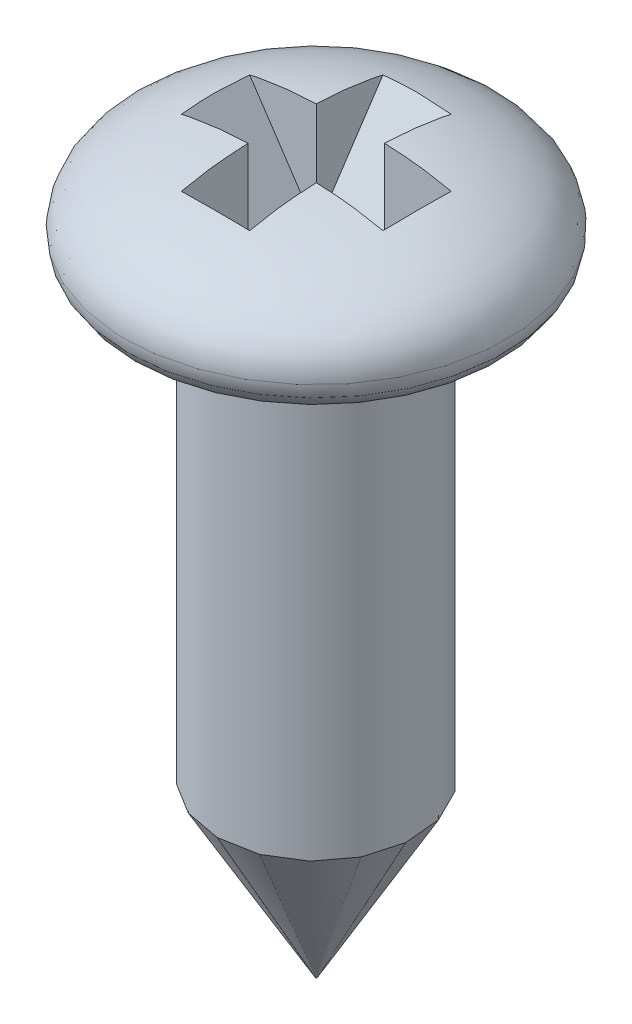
SolidWorks part; units mm, degrees
ref_plane "Plan de face" through (0, 0, 0) normal (0, 0, 1) x (1, 0, 0)
ref_plane "Plan de dessus" through (0, 0, 0) normal (0, 1, 0) x (1, 0, 0)
ref_plane "Plan de droite" through (0, 0, 0) normal (1, 0, 0) x (0, 0, -1)
ref_plane "Plan3" through (0, 6.4, 0) normal (0, 1, 0) x (-1, 0, 0)
sketch "Esquisse1" plane through (0, 6.4, 0) normal (0, 1, 0) x (-1, 0, 0)
  circle A0 centre (0, 0) radius 1.45
extrude "Extrusion1" add sketch "Esquisse1" against normal blind 9
sketch "Esquisse2" plane through (0, 0, 0) normal (0, 0, 1) x (1, 0, 0)
  line L0 (-3.5764, 6.4) -> (3.9855, 6.4) construction
  line L1 (0, 8.9067) -> (0, 4.7448) construction
  line L2 (-2.6992, 8) -> (4.0303, 8) construction
  line L3 (-2.8, 8.6386) -> (-2.8, 5.3938) construction
  line L4 (0, 6.4) -> (-2.3, 6.4)
  line L5 (0, 8) -> (0, 6.4)
  arc A0 (-2.3, 6.4) -> (-2.8, 6.9001) centre (-2.3, 6.9) cw
  spline S0 degree 3 poles (-2.8, 6.9001) (-2.802, 7.3106) (-1.7042, 7.9956) (-0.6729, 7.9983) (0, 8) knots 0 0 0 0 0.347597 1 1 1 1
  point P15 (-2.8, 6.4)
  point P18 (-2.8, 8)
  point P21 (0, 6.4)
  dimension "D1" = 0.5
revolve "Révolution1" add sketch "Esquisse2" angle 360 about L1
sketch "Esquisse3" plane through (0, 0, 0) normal (0, 0, 1) x (1, 0, 0)
  line L0 (0, 9.9885) -> (0, 5.1977) construction
  line L1 (-3.3122, 6.4) -> (4.0377, 6.4) construction
  line L2 (-3.6691, 0) -> (6.2564, 0) construction
  line L3 (-1.5, 8.9361) -> (-1.5, 5.7428) construction
  line L4 (-0.5, 7.218) -> (-0.5, 5.7428) construction
  line L5 (0, 8.589) -> (-1.5, 8.3981)
  line L6 (-2.5295, 7.9) -> (1.4809, 7.9) construction
  line L7 (-1.5, 8.3981) -> (-1.5, 7.9)
  line L8 (-1.5, 7.9) -> (-0.5, 6.4)
  line L9 (-0.5, 6.4) -> (0.5, 6.4)
  line L10 (1.5, 7.9) -> (0.5, 6.4)
  line L11 (1.5, 8.3981) -> (1.5, 7.9)
  line L12 (0, 8.589) -> (1.5, 8.3981)
  point P19 (0, 6.4)
extrude "Enlèv. mat.-Extru.1" cut sketch "Esquisse3" against normal mid plane 1
pattern_circular "Répétition circulaire1" count 2 every 90 about axis through (0, 0, 0) along (0, 1, 0) of "Enlèv. mat.-Extru.1"
chamfer "Chanfrein1" distance 1.44 distance2 2.5 1 edges at (0, -2.6, 1.45)
